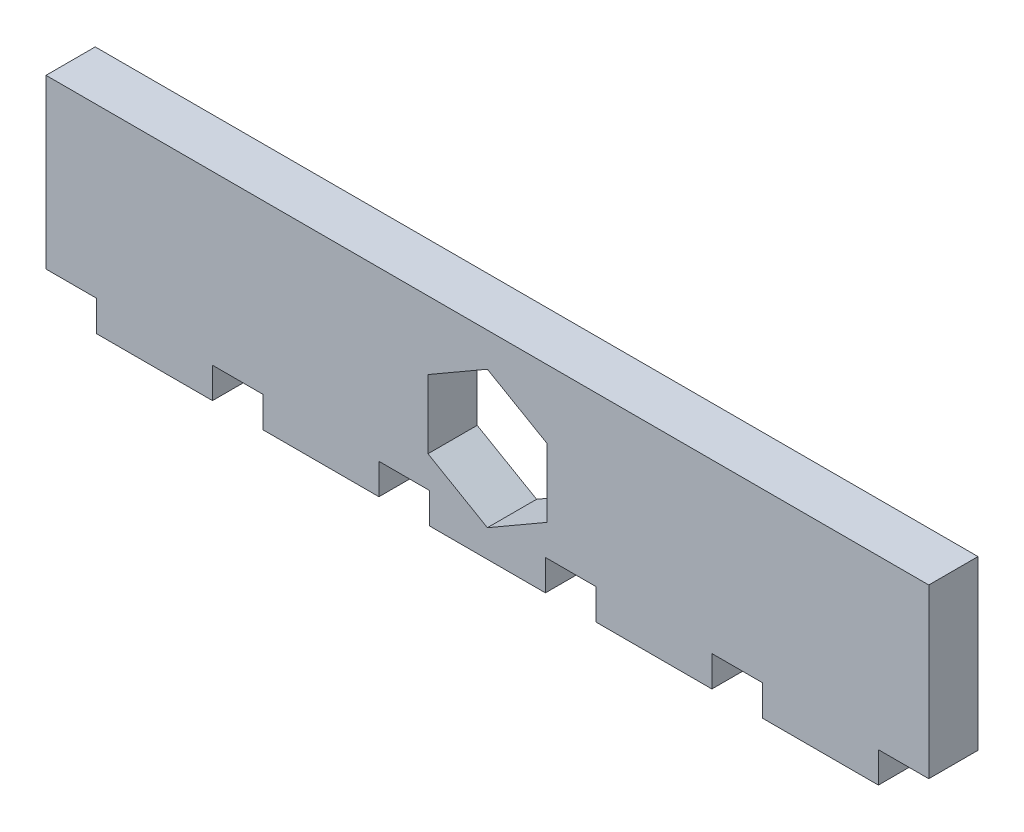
SolidWorks part; units mm, degrees
ref_plane "Front Plane" through (0, 0, 0) normal (0, 0, 1) x (1, 0, 0)
ref_plane "Top Plane" through (0, 0, 0) normal (0, 1, 0) x (1, 0, 0)
ref_plane "Right Plane" through (0, 0, 0) normal (1, 0, 0) x (0, 0, -1)
sketch "Sketch2" plane through (0, 0, 0) normal (0, 0, 1) x (1, 0, 0)
  line L0 (166.8969, 255.3259) -> (160.3969, 251.5732)
  line L1 (215.1823, 259.0303) -> (118.6115, 259.0303)
  line L2 (215.1823, 240.6725) -> (209.6705, 240.6725)
  line L3 (209.6705, 240.6725) -> (209.6705, 237.313)
  line L4 (215.1823, 240.6725) -> (215.1823, 259.0303)
  line L5 (160.3969, 251.5732) -> (160.3969, 244.0676)
  line L6 (160.3969, 244.0676) -> (166.8969, 240.3148)
  line L7 (166.8969, 240.3148) -> (173.3969, 244.0676)
  line L8 (173.3969, 244.0676) -> (173.3969, 251.5732)
  line L9 (173.3969, 251.5732) -> (166.8969, 255.3259)
  line L10 (209.6705, 237.313) -> (196.9705, 237.313)
  line L11 (196.9705, 237.313) -> (196.9705, 240.6725)
  line L12 (196.9705, 240.6725) -> (191.4587, 240.6725)
  line L13 (191.4587, 240.6725) -> (191.4587, 237.313)
  line L14 (191.4587, 237.313) -> (178.7587, 237.313)
  line L15 (178.7587, 237.313) -> (178.7587, 240.6725)
  line L16 (178.7587, 240.6725) -> (173.2469, 240.6725)
  line L17 (173.2469, 240.6725) -> (173.2469, 237.313)
  line L18 (173.2469, 237.313) -> (160.5469, 237.313)
  line L19 (160.5469, 237.313) -> (160.5469, 240.6725)
  line L20 (160.5469, 240.6725) -> (155.0351, 240.6725)
  line L21 (155.0351, 240.6725) -> (155.0351, 237.313)
  line L22 (155.0351, 237.313) -> (142.3351, 237.313)
  line L23 (142.3351, 237.313) -> (142.3351, 240.6725)
  line L24 (142.3351, 240.6725) -> (136.8233, 240.6725)
  line L25 (136.8233, 240.6725) -> (136.8233, 237.313)
  line L26 (136.8233, 237.313) -> (124.1233, 237.313)
  line L27 (124.1233, 237.313) -> (124.1233, 240.6725)
  line L28 (124.1233, 240.6725) -> (118.6115, 240.6725)
  line L29 (118.6115, 240.6725) -> (118.6115, 259.0303)
extrude "Boss-Extrude1" add sketch "Sketch2" along normal blind 5.3848
